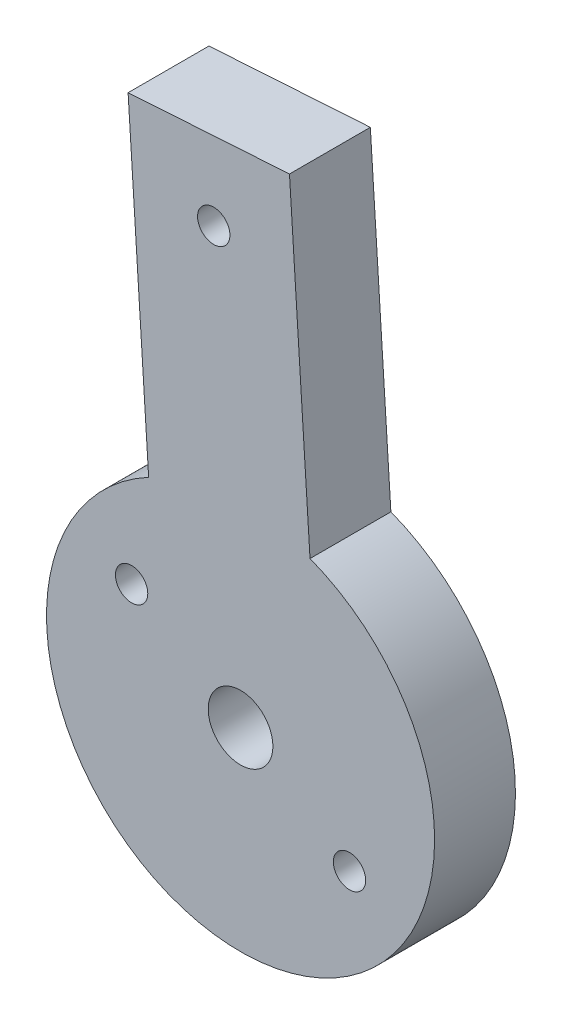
SolidWorks part; units mm, degrees
ref_plane "Front Plane" through (0, 0, 0) normal (0, 0, 1) x (1, 0, 0)
ref_plane "Top Plane" through (0, 0, 0) normal (0, 1, 0) x (1, 0, 0)
ref_plane "Right Plane" through (0, 0, 0) normal (1, 0, 0) x (0, 0, -1)
sketch "Sketch1" plane through (0, 0, 0) normal (0, 0, 1) x (1, 0, 0)
  line L1 (0, 0) -> (-0.6582, 10.3369) construction
  line L3 (-5.6831, 10.5689) -> (-6.954, 30.5285)
  line L4 (-6.954, 30.5285) -> (3.0258, 31.164)
  line L5 (3.0258, 31.164) -> (4.2967, 11.2044)
  arc A0 (-5.6831, 10.5689) -> (4.2967, 11.2044) centre (0, 0) ccw
  dimension "D1" = 20
extrude "Boss-Extrude1" add sketch "Sketch1" along normal blind 5
sketch "Sketch2" plane through (0, 0, 5) normal (0, 0, 1) x (1, 0, 0)
  line L0 (0, 0) -> (-1.9641, 30.8462) construction
  line L1 (3.0258, 31.164) -> (-6.954, 30.5285) construction
  circle A0 centre (0, 0) radius 2
  circle A1 centre (-1.6584, 26.0452) radius 1
  dimension "D1" = 26.098
extrude "Cut-Extrude1" cut sketch "Sketch2" against normal blind 5
sketch "Sketch3" plane through (0, 0, 5) normal (0, 0, 1) x (1, 0, 0)
  line L0 (0, 0) -> (7.2281, 0) construction
  line L1 (0, 0) -> (6.6318, -4.2468) construction
  line L2 (0, 0) -> (-6.3375, 4.0583) construction
  circle A0 centre (6.737, -4.3142) radius 1
  circle A1 centre (-6.737, 4.3142) radius 1
  circle A2 centre (0, 0) radius 2 construction
  dimension "D3" = 8
  dimension "D4" = 8
  dimension "D1" = 32.634
  dimension "D2" = 180
extrude "Cut-Extrude2" cut sketch "Sketch3" against normal blind 5
sketch "Sketch4" plane through (0, 0, 5) normal (0, 0, 1) x (1, 0, 0)
  line L0 (0, 0) -> (9.5161, 0)
